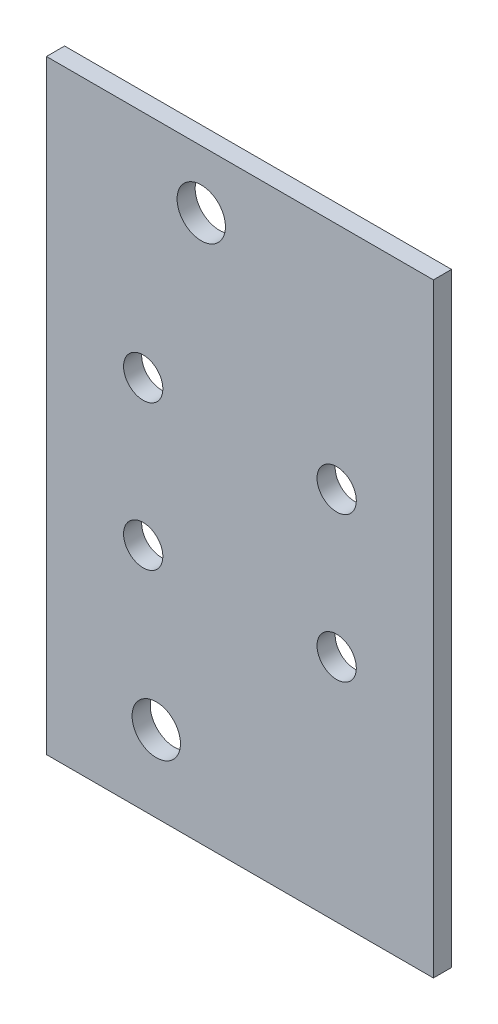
SolidWorks part; units mm, degrees
ref_plane "Front Plane" through (0, 0, 0) normal (0, 0, 1) x (1, 0, 0)
ref_plane "Top Plane" through (0, 0, 0) normal (0, 1, 0) x (1, 0, 0)
ref_plane "Right Plane" through (0, 0, 0) normal (1, 0, 0) x (0, 0, -1)
sketch "Sketch1" plane through (0, 0, 0) normal (0, 0, 1) x (1, 0, 0)
  line L1 (0, 0) -> (-203.2, 0)
  line L2 (0, 0) -> (0, -317.5)
  line L3 (0, -317.5) -> (-203.2, -317.5)
  line L4 (-203.2, 0) -> (-203.2, -317.5)
  dimension "D1" = 203.2
  dimension "D2" = 317.5
extrude "Extrude1" add sketch "Sketch1" along normal blind 9.525
sketch "Sketch2" plane through (0, 0, 9.525) normal (0, 0, 1) x (1, 0, 0)
  line L0 (0, -317.5) -> (0, 0) construction
  line L1 (-203.2, -317.5) -> (0, -317.5) construction
  circle A0 centre (-50.8, -120.65) radius 10.3188
  dimension "D1" = 20.6375
  dimension "D2" = 50.8
  dimension "D3" = 196.85
ref_plane "Plane1" through (0, -158.75, 0) normal (0, 1, 0) x (-1, 0, 0)
sketch "Sketch3" plane through (0, 0, 9.525) normal (0, 0, 1) x (1, 0, 0)
  line L0 (0, -317.5) -> (0, 0) construction
  line L1 (-203.2, -317.5) -> (0, -317.5) construction
  circle A0 centre (-152.4, -120.65) radius 10.3187
  dimension "D1" = 20.6375
  dimension "D2" = 152.4
  dimension "D3" = 196.85
extrude "Cut-Extrude1" cut sketch "Sketch3" against normal blind 9.525
extrude "Cut-Extrude2" cut sketch "Sketch2" against normal blind 9.525
mirror "Mirror1" about plane through (0, -158.75, 0) normal (0, 1, 0) of "Cut-Extrude1", "Cut-Extrude2"
sketch "Sketch4" plane through (0, 0, 9.525) normal (0, 0, 1) x (1, 0, 0)
  line L0 (0, -317.5) -> (0, 0) construction
  line L1 (-203.2, -317.5) -> (0, -317.5) construction
  circle A0 centre (-121.92, -30.48) radius 12.7
  dimension "D1" = 25.4
  dimension "D2" = 121.92
  dimension "D3" = 287.02
extrude "Cut-Extrude3" cut sketch "Sketch4" against normal through all
sketch "Sketch5" plane through (0, 0, 9.525) normal (0, 0, 1) x (1, 0, 0)
  line L0 (0, -317.5) -> (0, 0) construction
  line L1 (0, 0) -> (-203.2, 0) construction
  circle A0 centre (-145.542, -277.368) radius 12.7
  dimension "D1" = 25.4
  dimension "D2" = 145.542
  dimension "D3" = 277.368
extrude "Cut-Extrude4" cut sketch "Sketch5" against normal through all
